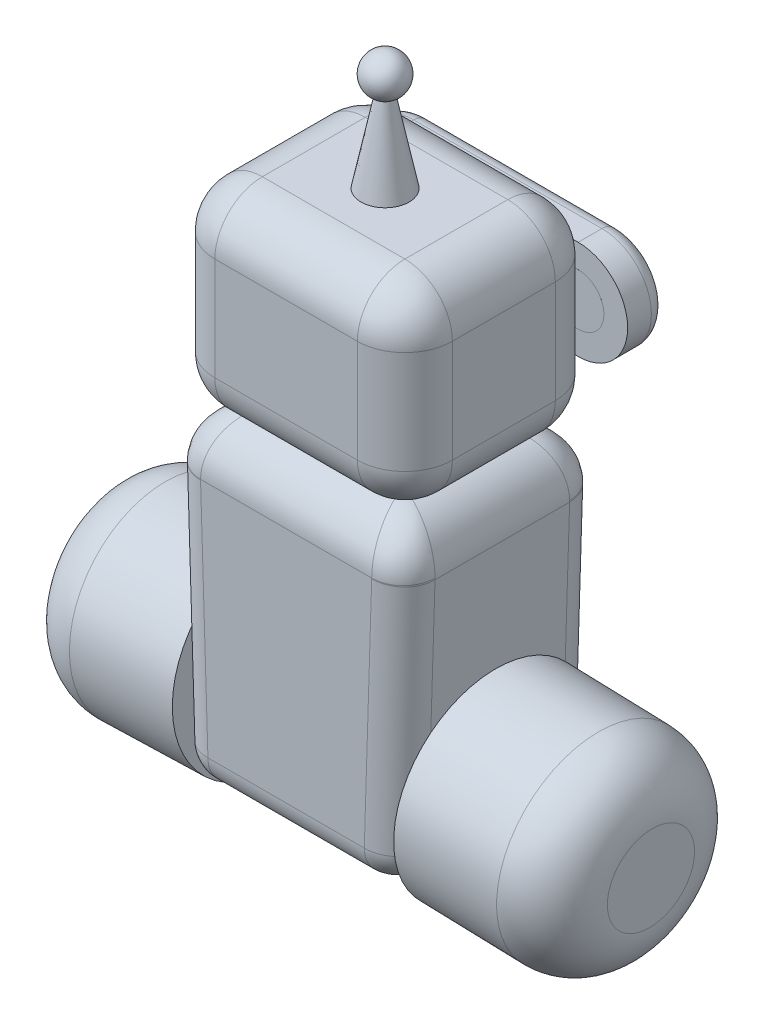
SolidWorks part; units mm, degrees
ref_plane "Front" through (0, 0, 0) normal (0, 0, 1) x (1, 0, 0)
ref_plane "Top" through (0, 0, 0) normal (0, 1, 0) x (1, 0, 0)
ref_plane "Right" through (0, 0, 0) normal (1, 0, 0) x (0, 0, -1)
sketch "Sketch1" plane through (0, 0, 0) normal (0, 0, 1) x (1, 0, 0)
  line L1 (0, 0) -> (76.2, 0)
  line L2 (0, 0) -> (0, 63.5)
  line L3 (0, 63.5) -> (76.2, 63.5)
  line L4 (76.2, 0) -> (76.2, 63.5)
  dimension "D1" = 76.2
  dimension "D2" = 63.5
extrude "Extrude1" add sketch "Sketch1" along normal blind 63.5
sketch "Sketch2" plane through (0, 0, 0) normal (0, 0, 1) x (1, 0, 0)
  line L0 (0, 0) -> (76.2, 0)
  line L1 (76.2, 0) -> (73.025, -101.6)
  line L2 (73.025, -101.6) -> (3.175, -101.6)
  line L3 (38.1, -101.6) -> (38.1, 0) construction
  line L4 (0, 0) -> (3.175, -101.6)
  dimension "D1" = 34.925
  dimension "D2" = 101.6
extrude "Extrude3" add sketch "Sketch2" along normal blind 63.5 separate body
fillet "Fillet2" radius 15.24 11 edges at (76.2, 0, 31.75) (76.2, 31.75, 63.5) (76.2, 63.5, 31.75) (76.2, 31.75, 0) (0, 63.5, 31.75) (0, 31.75, 63.5) (0, 0, 31.75) (0, 31.75, 0) (38.1, 0, 63.5) (38.1, 63.5, 0) (38.1, 63.5, 63.5)
fillet "Fillet3" radius 15.24 4 edges at (76.2, 0, 31.75) (38.1, 0, 63.5) (0, 0, 31.75) (38.1, 0, 0)
fillet "Fillet4" radius 15.24 3 edges at (4.4637, 4.4637, 4.4637) (71.7363, 4.4637, 4.4637) (38.1, 0, 0)
fillet "Fillet5" radius 10.16 7 edges at (4.9474, -4.4637, 59.0363) (71.2526, -4.4637, 59.0363) (38.1, -101.6, 63.5) (1.8331, -58.658, 63.5) (0.4855, -15.478, 63.5) (75.7145, -15.478, 63.5) (74.3669, -58.658, 63.5)
fillet "Fillet6" radius 10.16 5 edges at (4.9474, -4.4637, 4.4637) (0.4855, -15.478, 0) (6.0593, -98.6242, 60.5242) (1.8331, -58.658, 0) (3.175, -101.6, 26.67)
fillet "Fillet7" radius 10.16 7 edges at (70.1407, -98.6242, 60.5242) (5.9513, -98.7355, 3.0889) (71.2526, -4.4637, 4.4637) (73.025, -101.6, 26.67) (43.1825, -101.6, 0) (74.3669, -58.658, 0) (75.7145, -15.478, 0)
sketch "Sketch3" plane through (0, 0, 0) normal (-0.9995, -0.0312, 0) x (0, 0, 1)
  line L0 (48.4187, -0.4837) -> (15.0813, -0.4837) construction
  circle A0 centre (32.7399, -83.0337) radius 31.75
  dimension "D1" = 63.5
  dimension "D2" = 82.55
extrude "Extrude4" add sketch "Sketch3" along normal blind 50.8
ref_plane "Plane1" through (38.1, 0, 0) normal (1, 0, 0) x (0, 0, -1)
mirror "Mirror1" about plane through (38.1, 0, 0) normal (1, 0, 0) of "Extrude4"
fillet "Fillet9" radius 17.78 2 edges at (-47.19, -116.3144, 32.7399) (123.39, -116.3144, 32.7399)
sketch "Sketch4" plane through (0, 0, 0) normal (0, 0, -1) x (-1, 0, 0)
  line L0 (-38.1, 48.26) -> (-38.1, 15.24) construction
  line L1 (-60.96, 48.26) -> (-15.24, 48.26) construction
  line L2 (-15.24, 15.24) -> (-60.96, 15.24) construction
  line L3 (-60.96, 30.7314) -> (-60.96, 31.75) construction
  line L4 (-60.96, 15.24) -> (-60.96, 48.26) construction
  line L5 (-60.96, 31.75) -> (-15.24, 31.75) construction
  line L6 (-15.24, 48.26) -> (-15.24, 15.24) construction
  line L7 (-7.9012, 47.6901) -> (-68.2885, 47.6901)
  line L9 (-7.9012, 15.8099) -> (-68.2885, 15.9401)
  line L10 (-7.8943, 23.4299) -> (-68.2816, 23.5601)
  line L11 (-7.9012, 40.0701) -> (-68.2885, 40.0701) construction
  line L13 (-68.2885, 40.0701) -> (-7.9012, 40.0701)
  arc A0 (-7.9012, 47.6901) -> (-7.9012, 15.8099) centre (-7.9012, 31.75) cw
  arc A1 (-68.2885, 15.9401) -> (-68.2885, 47.6901) centre (-68.2885, 31.8151) cw
  arc A2 (-68.2816, 23.5601) -> (-68.2885, 40.0701) centre (-68.2885, 31.8151) cw
  arc A3 (-7.9012, 40.0701) -> (-7.8943, 23.4299) centre (-7.9012, 31.75) cw
  point P17 (-81.8282, 31.75)
  point P19 (-38.1, 15.875)
  point P20 (-38.1, 47.625)
  dimension "D1" = 7.62
  dimension "D2" = 60.3873
extrude "Extrude6" add sketch "Sketch4" along normal blind 12.7
fillet "Fillet18" radius 5.08 4 edges at (38.0948, 15.875, -12.7) (-8.0389, 31.75, -12.7) (38.0948, 47.6901, -12.7) (84.1635, 31.8151, -12.7)
sketch "Sketch6" plane through (0, 0, 0) normal (0, 0, -1) x (-1, 0, 0)
  line L0 (-68.2816, 23.5601) -> (-7.8943, 23.4299) construction
  line L1 (-68.2816, 23.5601) -> (-7.8943, 23.4299)
  line L3 (-68.7681, 40.0561) -> (-7.9012, 40.0701)
  line L4 (-38.0879, 40.0701) -> (-38.0879, 23.495) construction
  arc A0 (-7.8943, 23.4299) -> (-7.9012, 40.0701) centre (-7.9012, 31.75) ccw construction
  arc A1 (-7.8943, 23.4299) -> (-7.9012, 40.0701) centre (-7.9012, 31.75) ccw
  arc A2 (-68.2885, 40.0701) -> (-68.2816, 23.5601) centre (-68.2885, 31.8151) ccw construction
  arc A3 (-68.7681, 40.0561) -> (-68.2816, 23.5601) centre (-68.2885, 31.8151) ccw
extrude "Extrude7" add sketch "Sketch6" along normal blind 12.446 separate body
sketch "Sketch7" plane through (0, 0, 0) normal (0, 0, -1) x (-1, 0, 0)
  line L1 (-7.9012, 40.0701) -> (-68.2885, 40.0701) construction
  circle A1 centre (-47.6718, 33.7201) radius 6.35
  circle A3 centre (-28.5041, 33.7201) radius 6.35
  dimension "D1" = 6.35
  dimension "D2" = 6.35
extrude "Extrude8" add sketch "Sketch7" along normal blind 12.7 separate body
ref_plane "Plane2" through (0, 0, 31.75) normal (0, 0, 1) x (1, 0, 0)
sketch "Sketch9" plane through (0, 0, 31.75) normal (0, 0, 1) x (1, 0, 0)
  line L0 (38.1, 63.5) -> (38.1, 101.6) construction
  line L1 (60.96, 63.5) -> (15.24, 63.5) construction
  line L2 (38.1, 101.6) -> (30.3762, 63.5)
  line L3 (30.3762, 63.5) -> (38.1, 63.5)
  line L4 (38.1, 63.5) -> (38.1, 101.6)
  dimension "D1" = 38.1
revolve "Revolve1" add sketch "Sketch9" angle 360 about L0
sketch "Sketch10" plane through (0, 0, 31.75) normal (0, 0, 1) x (1, 0, 0)
  line L0 (38.1, 63.7866) -> (38.1, 101.6) construction
  line L1 (38.1, -18.161) -> (38.1, 18.161) construction
  line L2 (38.1, 101.6) -> (30.3762, 63.5) construction
  line L3 (38.1, 101.6) -> (38.1, 88.9)
  arc A0 (38.1, 88.9) -> (38.1, 101.6) centre (38.1, 95.25) cw
  dimension "D1" = 6.35
revolve "Revolve2" add sketch "Sketch10" angle 360 about L0
sketch "Sketch11" plane through (0, 0, 0) normal (0, 0, -1) x (-1, 0, 0)
  line L0 (-10.6437, -15.24) -> (-65.5563, -15.24) construction
  line L1 (-63.1775, -91.44) -> (-13.0225, -91.44)
  line L2 (-13.0225, -91.44) -> (-13.0225, -15.24)
  line L3 (-63.1775, -91.44) -> (-63.1775, -15.24)
  line L4 (-63.1775, -15.24) -> (-13.0225, -15.24)
  line L5 (-26.0935, -60.706) -> (-26.0935, -53.086)
  line L6 (-58.8595, -76.962) -> (-58.8595, -69.342)
  line L7 (-58.8595, -69.342) -> (-51.2395, -69.342)
  line L8 (-26.0935, -53.086) -> (-18.4735, -53.086)
  line L9 (-58.8595, -85.09) -> (-51.2395, -85.09)
  line L10 (-58.8595, -85.09) -> (-51.2395, -85.09)
  line L11 (-58.8595, -85.09) -> (-58.8595, -77.47)
  line L12 (-58.8595, -77.47) -> (-51.2395, -77.47)
  line L13 (-51.2395, -85.09) -> (-51.2395, -77.47)
  line L14 (-51.2395, -76.962) -> (-51.2395, -69.342)
  line L15 (-58.8595, -76.962) -> (-51.2395, -76.962)
  line L16 (-58.8595, -68.834) -> (-58.8595, -61.214)
  line L17 (-58.8595, -61.214) -> (-51.2395, -61.214)
  line L18 (-51.2395, -68.834) -> (-51.2395, -61.214)
  line L19 (-58.8595, -68.834) -> (-51.2395, -68.834)
  line L20 (-58.8595, -60.706) -> (-58.8595, -53.086)
  line L21 (-58.8595, -53.086) -> (-51.2395, -53.086)
  line L22 (-51.2395, -60.706) -> (-51.2395, -53.086)
  line L23 (-58.8595, -60.706) -> (-51.2395, -60.706)
  line L24 (-58.8595, -52.578) -> (-58.8595, -44.958)
  line L25 (-58.8595, -44.958) -> (-51.2395, -44.958)
  line L26 (-51.2395, -52.578) -> (-51.2395, -44.958)
  line L27 (-58.8595, -52.578) -> (-51.2395, -52.578)
  line L28 (-58.8595, -44.45) -> (-58.8595, -36.83)
  line L29 (-58.8595, -36.83) -> (-51.2395, -36.83)
  line L30 (-51.2395, -44.45) -> (-51.2395, -36.83)
  line L31 (-58.8595, -44.45) -> (-51.2395, -44.45)
  line L32 (-58.8595, -36.322) -> (-58.8595, -28.702)
  line L33 (-58.8595, -28.702) -> (-51.2395, -28.702)
  line L34 (-51.2395, -36.322) -> (-51.2395, -28.702)
  line L35 (-58.8595, -36.322) -> (-51.2395, -36.322)
  line L36 (-49.9695, -52.578) -> (-49.9695, -44.958)
  line L37 (-49.9695, -44.958) -> (-42.3495, -44.958)
  line L38 (-42.3495, -52.578) -> (-42.3495, -44.958)
  line L39 (-49.9695, -52.578) -> (-42.3495, -52.578)
  line L40 (-49.9695, -85.09) -> (-42.3495, -85.09)
  line L41 (-49.9695, -85.09) -> (-49.9695, -77.47)
  line L42 (-49.9695, -77.47) -> (-42.3495, -77.47)
  line L43 (-42.3495, -85.09) -> (-42.3495, -77.47)
  line L44 (-41.8415, -52.578) -> (-41.8415, -44.958)
  line L45 (-41.8415, -44.958) -> (-34.2215, -44.958)
  line L46 (-34.2215, -52.578) -> (-34.2215, -44.958)
  line L47 (-41.8415, -52.578) -> (-34.2215, -52.578)
  line L48 (-41.8415, -85.09) -> (-41.8415, -77.47)
  line L49 (-41.8415, -77.47) -> (-34.2215, -77.47)
  line L50 (-34.2215, -85.09) -> (-34.2215, -77.47)
  line L51 (-41.8415, -85.09) -> (-34.2215, -85.09)
  line L52 (-33.7135, -52.578) -> (-33.7135, -44.958)
  line L53 (-33.7135, -44.958) -> (-26.0935, -44.958)
  line L54 (-26.0935, -52.578) -> (-26.0935, -44.958)
  line L55 (-33.7135, -52.578) -> (-26.0935, -52.578)
  line L56 (-33.7135, -85.09) -> (-33.7135, -77.47)
  line L57 (-33.7135, -77.47) -> (-26.0935, -77.47)
  line L58 (-26.0935, -85.09) -> (-26.0935, -77.47)
  line L59 (-33.7135, -85.09) -> (-26.0935, -85.09)
  line L60 (-18.4735, -60.706) -> (-18.4735, -53.086)
  line L61 (-26.0935, -60.706) -> (-18.4735, -60.706)
  line L62 (-26.0935, -68.834) -> (-26.0935, -61.214)
  line L63 (-26.0935, -61.214) -> (-18.4735, -61.214)
  line L64 (-18.4735, -68.834) -> (-18.4735, -61.214)
  line L65 (-26.0935, -68.834) -> (-18.4735, -68.834)
  line L66 (-26.0935, -76.962) -> (-26.0935, -69.342)
  line L67 (-26.0935, -69.342) -> (-18.4735, -69.342)
  line L68 (-18.4735, -76.962) -> (-18.4735, -69.342)
  line L69 (-26.0935, -76.962) -> (-18.4735, -76.962)
  dimension "D1" = 50.1551
  dimension "D2" = 7
  dimension "D3" = 76.2
  dimension "D4" = 2
  dimension "D5" = 4.318
  dimension "D6" = 3
  dimension "D7" = 7.62
  dimension "D8" = 2
sketch "Sketch12" plane through (0, 0, 0) normal (0, 0, -1) x (-1, 0, 0)
  line L0 (-26.0935, -60.706) -> (-26.0935, -53.086)
  line L1 (-58.8595, -76.962) -> (-58.8595, -69.342)
  line L2 (-58.8595, -69.342) -> (-51.2395, -69.342)
  line L3 (-26.0935, -53.086) -> (-18.4735, -53.086)
  line L4 (-58.8595, -85.09) -> (-51.2395, -85.09)
  line L6 (-58.8595, -85.09) -> (-58.8595, -77.47)
  line L7 (-58.8595, -77.47) -> (-51.2395, -77.47)
  line L8 (-51.2395, -85.09) -> (-51.2395, -77.47)
  line L9 (-51.2395, -76.962) -> (-51.2395, -69.342)
  line L10 (-58.8595, -76.962) -> (-51.2395, -76.962)
  line L11 (-58.8595, -68.834) -> (-58.8595, -61.214)
  line L12 (-58.8595, -61.214) -> (-51.2395, -61.214)
  line L13 (-51.2395, -68.834) -> (-51.2395, -61.214)
  line L14 (-58.8595, -68.834) -> (-51.2395, -68.834)
  line L15 (-58.8595, -60.706) -> (-58.8595, -53.086)
  line L16 (-58.8595, -53.086) -> (-51.2395, -53.086)
  line L17 (-51.2395, -60.706) -> (-51.2395, -53.086)
  line L18 (-58.8595, -60.706) -> (-51.2395, -60.706)
  line L19 (-58.8595, -52.578) -> (-58.8595, -44.958)
  line L20 (-58.8595, -44.958) -> (-51.2395, -44.958)
  line L21 (-51.2395, -52.578) -> (-51.2395, -44.958)
  line L22 (-58.8595, -52.578) -> (-51.2395, -52.578)
  line L23 (-58.8595, -44.45) -> (-58.8595, -36.83)
  line L24 (-58.8595, -36.83) -> (-51.2395, -36.83)
  line L25 (-51.2395, -44.45) -> (-51.2395, -36.83)
  line L26 (-58.8595, -44.45) -> (-51.2395, -44.45)
  line L27 (-58.8595, -36.322) -> (-58.8595, -28.702)
  line L28 (-58.8595, -28.702) -> (-51.2395, -28.702)
  line L29 (-51.2395, -36.322) -> (-51.2395, -28.702)
  line L30 (-58.8595, -36.322) -> (-51.2395, -36.322)
  line L31 (-49.9695, -52.578) -> (-49.9695, -44.958)
  line L32 (-49.9695, -44.958) -> (-42.3495, -44.958)
  line L33 (-42.3495, -52.578) -> (-42.3495, -44.958)
  line L34 (-49.9695, -52.578) -> (-42.3495, -52.578)
  line L35 (-49.9695, -85.09) -> (-42.3495, -85.09)
  line L36 (-49.9695, -85.09) -> (-49.9695, -77.47)
  line L37 (-49.9695, -77.47) -> (-42.3495, -77.47)
  line L38 (-42.3495, -85.09) -> (-42.3495, -77.47)
  line L39 (-41.8415, -52.578) -> (-41.8415, -44.958)
  line L40 (-41.8415, -44.958) -> (-34.2215, -44.958)
  line L41 (-34.2215, -52.578) -> (-34.2215, -44.958)
  line L42 (-41.8415, -52.578) -> (-34.2215, -52.578)
  line L43 (-41.8415, -85.09) -> (-41.8415, -77.47)
  line L44 (-41.8415, -77.47) -> (-34.2215, -77.47)
  line L45 (-34.2215, -85.09) -> (-34.2215, -77.47)
  line L46 (-41.8415, -85.09) -> (-34.2215, -85.09)
  line L47 (-33.7135, -52.578) -> (-33.7135, -44.958)
  line L48 (-33.7135, -44.958) -> (-26.0935, -44.958)
  line L49 (-26.0935, -52.578) -> (-26.0935, -44.958)
  line L50 (-33.7135, -52.578) -> (-26.0935, -52.578)
  line L51 (-33.7135, -85.09) -> (-33.7135, -77.47)
  line L52 (-33.7135, -77.47) -> (-26.0935, -77.47)
  line L53 (-26.0935, -85.09) -> (-26.0935, -77.47)
  line L54 (-33.7135, -85.09) -> (-26.0935, -85.09)
  line L55 (-18.4735, -60.706) -> (-18.4735, -53.086)
  line L56 (-26.0935, -60.706) -> (-18.4735, -60.706)
  line L57 (-26.0935, -68.834) -> (-26.0935, -61.214)
  line L58 (-26.0935, -61.214) -> (-18.4735, -61.214)
  line L59 (-18.4735, -68.834) -> (-18.4735, -61.214)
  line L60 (-26.0935, -68.834) -> (-18.4735, -68.834)
  line L61 (-26.0935, -76.962) -> (-26.0935, -69.342)
  line L62 (-26.0935, -69.342) -> (-18.4735, -69.342)
  line L63 (-18.4735, -76.962) -> (-18.4735, -69.342)
  line L64 (-26.0935, -76.962) -> (-18.4735, -76.962)
extrude "Cut-Extrude2" cut sketch "Sketch12" against normal blind 1.524
